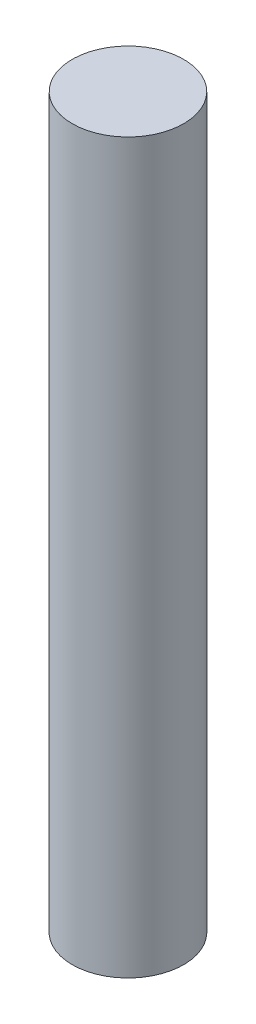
SolidWorks part; units mm, degrees
ref_plane "Front Plane" through (0, 0, 0) normal (0, 0, 1) x (1, 0, 0)
ref_plane "Top Plane" through (0, 0, 0) normal (0, 1, 0) x (1, 0, 0)
ref_plane "Right Plane" through (0, 0, 0) normal (1, 0, 0) x (0, 0, -1)
sketch "Sketch1" plane through (0, 0, 0) normal (0, 1, 0) x (1, 0, 0)
  circle A0 centre (0, 0) radius 1.905
  dimension "D1" = 3.81
extrude "Boss-Extrude1" add sketch "Sketch1" along normal blind 24.892
